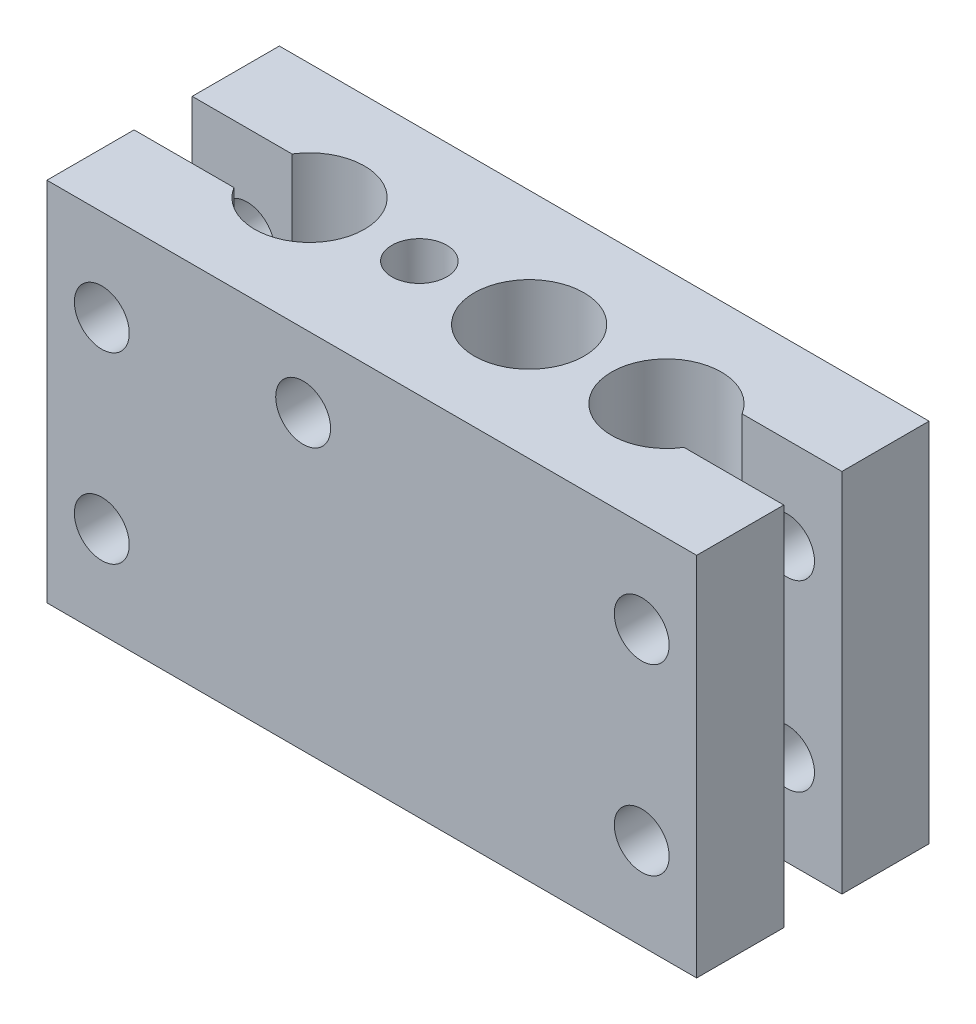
SolidWorks part; units mm, degrees
other "Markup1"
sketch "Sketch4" plane through (24, 12.7, 6.35) normal (0.1665, 0.6992, 0.6953) x (0.9508, 0.073, -0.3011)
ref_plane "Front Plane" through (0, 0, 0) normal (0, 0, 1) x (1, 0, 0)
ref_plane "Top Plane" through (0, 0, 0) normal (0, 1, 0) x (1, 0, 0)
ref_plane "Right Plane" through (0, 0, 0) normal (1, 0, 0) x (0, 0, -1)
sketch "Sketch1" plane through (0, 0, 0) normal (0, 0, 1) x (1, 0, 0)
  line L1 (-17.75, -10) -> (17.75, -10)
  line L2 (-17.75, -10) -> (-17.75, 10)
  line L3 (-17.75, 10) -> (17.75, 10)
  line L4 (17.75, -10) -> (17.75, 10)
  line L5 (-17.75, -10) -> (17.75, 10) construction
  line L6 (-17.75, 10) -> (17.75, -10) construction
  point P0 (0, 0)
  dimension "D1" = 20
  dimension "D2" = 35.5
extrude "Boss-Extrude1" add sketch "Sketch1" along normal mid plane 12.7
sketch "Sketch2" plane through (0, 10, 0) normal (0, 1, 0) x (1, 0, 0)
  line L0 (17.75, -6.35) -> (17.75, 6.35) construction
  line L1 (0, -55) -> (0, 55) construction
  line L2 (-12.2956, -1.5875) -> (-12.2956, 1.5875)
  line L4 (-17.75, -1.5875) -> (-17.75, 1.5875)
  line L5 (12.2956, -1.5875) -> (17.75, -1.5875)
  line L6 (12.2956, -1.5875) -> (12.2956, 1.5875)
  line L7 (12.2956, 1.5875) -> (17.75, 1.5875)
  line L8 (17.75, -1.5875) -> (17.75, 1.5875)
  line L9 (-12.2956, 1.5875) -> (-17.75, 1.5875)
  line L10 (-12.2956, -1.5875) -> (-17.75, -1.5875)
  circle A0 centre (9.75, 0) radius 3
  circle A1 centre (2.25, 0) radius 3
  circle A2 centre (-3.75, 0) radius 1.5
  circle A3 centre (-9.75, 0) radius 3
  dimension "D1" = 6
  dimension "D2" = 6
  dimension "D3" = 3
  dimension "D4" = 3.175
  dimension "D5" = 8
  dimension "D6" = 7.5
  dimension "D7" = 6
extrude "Cut-Extrude1" cut sketch "Sketch2" against normal through all both and the other way through all contours A0 L5 L7 M9 | L6 A0 | A1 | A2 | A3 | L2 L9 L4 L10
sketch "Sketch3" plane through (0, 0, 6.35) normal (0, 0, 1) x (1, 0, 0)
  line L0 (14.75, -5) -> (14.75, 5) construction
  line L1 (17.75, -10) -> (17.75, 10) construction
  line L2 (17.75, 10) -> (-17.75, 10) construction
  line L4 (0, -55) -> (0, 55) construction
  circle A0 centre (14.75, 5) radius 1.5
  circle A1 centre (14.75, -5) radius 1.5
  circle A2 centre (-3.75, 6) radius 1.5
  circle A3 centre (-14.75, -5) radius 1.5
  circle A4 centre (-14.75, 5) radius 1.5
  point P6 (14.75, 0)
  dimension "D3" = 3
  dimension "D6" = 3
  dimension "D1" = 3
  dimension "D2" = 10
  dimension "D4" = 4
  dimension "D5" = 21.5
extrude "Cut-Extrude2" cut sketch "Sketch3" against normal through all both and the other way through all
